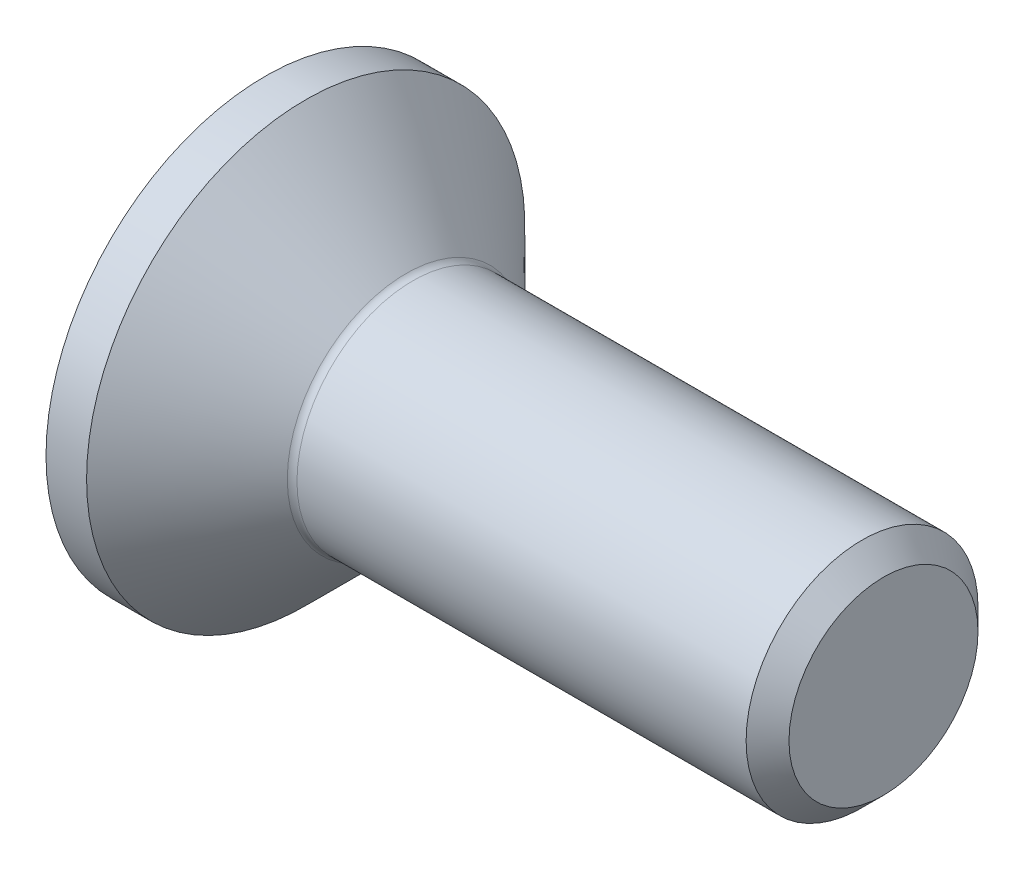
SolidWorks part; units mm, degrees
ref_plane "Plane1" through (0, 0, 0) normal (0, 0, 1) x (1, 0, 0)
ref_plane "Plane2" through (0, 0, 0) normal (0, 1, 0) x (1, 0, 0)
ref_plane "Plane3" through (0, 0, 0) normal (1, 0, 0) x (0, 0, -1)
sketch "BodySke" plane through (0, 0, 0) normal (0, 0, 1) x (1, 0, 0)
  line L0 (0, 0) -> (0, 5.67)
  line L1 (1.05, 5.67) -> (3.72, 3)
  line L2 (0, 5.67) -> (1.05, 5.67)
  line L3 (3.72, 3) -> (15.4455, 3)
  line L4 (16, 2.4455) -> (16, 0)
  line L5 (16, 0) -> (0, 0)
  line L6 (0, 0) -> (127, 0) construction
  line L7 (1.05, -5.67) -> (3.72, -3) construction
  line L8 (16, 2.4455) -> (15.4455, 3)
  line L9 (0, -5.67) -> (1.05, -5.67) construction
  line L10 (16, -2.4455) -> (15.4455, -3) construction
  line L11 (4.72, 9.35) -> (4.72, -12.875) construction
  line L12 (0, 19.05) -> (0, -3.175) construction
  dimension "D1" = 1.05
  dimension "Diameter" = 6
  dimension "Head_ht" = 3.72
  dimension "Length" = 16
  dimension "Body_ch_ang" = 45
  dimension "Head_dia" = 11.34
  dimension "Minor_dia" = 4.891
  dimension "Head_ang" = 90
  dimension "Advance" = 1
  dimension "Thread_nom" = 16
revolve "BaseBody" add sketch "BodySke"
fillet "Fillet1" radius 0.25 1 edges at (3.72, 0, 3)
sketch "Sketch2" plane through (0, 0, 0) normal (0, 0, 1) x (1, 0, 0)
  line L0 (0, 2) -> (2.2, 2)
  line L1 (2.2, 2) -> (3.3547, 0)
  line L2 (0, 0) -> (127, 0) construction
  line L3 (3.3547, 0) -> (0, 0)
  line L4 (0, 0) -> (0, 2)
  line L5 (0, -2) -> (2.2, -2) construction
  line L6 (0, 0) -> (47.625, 0) construction
  line L8 (0, 5.67) -> (0, -5.67) construction
  dimension "D2" = 60
  dimension "PreBroach_depth" = 2.2
  dimension "PreBroach_dia" = 4
revolve "PreBroach" cut sketch "Sketch2" angle 360 about L6
sketch "Sketch3" plane through (0, 0, 0) normal (-1, 0, 0) x (0, 0, 1)
  line L0 (-2, -1.1547) -> (-2, 1.1547)
  line L1 (-2, 1.1547) -> (0, 2.3094)
  line L2 (0, 2.3094) -> (2, 1.1547)
  line L3 (2, 1.1547) -> (2, -1.1547)
  line L4 (2, -1.1547) -> (0, -2.3094)
  line L5 (0, -2.3094) -> (-2, -1.1547)
  dimension "D1" = 2
  dimension "D2" = 2
  dimension "D3" = 4
  dimension "Hex_size" = 4
extrude "Hex" cut sketch "Sketch3" against normal blind 2.2
sketch "ThdSchSke" plane through (0, 0, 0) normal (0, 0, 1) x (1, 0, 0)
  line L0 (6.72, -2.4455) -> (6.3317, -3)
  line L1 (6.72, -2.4455) -> (7.1083, -3)
  line L2 (7.1083, -3) -> (7.1083, -3.75)
  line L3 (-3.175, 0) -> (5.1513, 0) construction
  line L4 (0, 5.67) -> (0, -5.67) construction
  line L5 (7.1083, -3.75) -> (6.3317, -3.75)
  line L6 (6.3317, -3.75) -> (6.3317, -3)
  dimension "Thread_minor" = 4.891
  dimension "Diameter" = 6
  dimension "Start" = 6.72
  dimension "SideAngle" = 55
  dimension "VeeAngle" = 70
  dimension "Overcut" = 7.5
revolve "ThreadSchematic" [suppressed] cut sketch "ThdSchSke" angle 360 about L3
pattern_linear "ThdSchPat" [suppressed]
equation "\"Thread_minor@ThreadCosmetic\"  =  \"Minor_dia@BodySke\""
equation "\"D1@Sketch3\" = \"Hex_size@Sketch3\" / 2"
equation "\"D2@Sketch3\" = \"D1@Sketch3\""
equation "\"D3@Sketch3\" = \"Hex_size@Sketch3\""
equation "\"Thread_length@ThreadCosmetic\" = ((sgn( (\"Length@BodySke\" - \"Advance@BodySke\" * 3.0 - \"Head_ht@BodySke\" ) - \"Thread_nom@BodySke\" )-1)*( (\"Length@BodySke\" - \"Advance@BodySke\" * 3.0 - \"Head_ht@BodySke\" "
equation "\"Thread_minor@ThdSchSke\" = \"Minor_dia@BodySke\""
equation "\"Diameter@ThdSchSke\" = \"Diameter@BodySke\""
equation "\"Overcut@ThdSchSke\" = \"Diameter@BodySke\" * 1.25"
equation "\"Start@ThdSchSke\" = 0.000001 + \"Length@BodySke\" - \"Thread_length@ThreadCosmetic\"  '---Countersunk---"
equation "\"Num_threads@ThdSchPat\" = int( \"Thread_length@ThreadCosmetic\" / \"Advance@BodySke\" + 0.999 )  + 1"
equation "\"Advance@ThdSchPat\" = \"Thread_length@ThreadCosmetic\" /  (\"Num_threads@ThdSchPat\" - 1) 'relax it"
equation "\"Num_threads@ThdSchPat\" = \"Num_threads@ThdSchPat\" - sgn( \"Num_threads@ThdSchPat\" - 1) '---chamfered tips only---"
